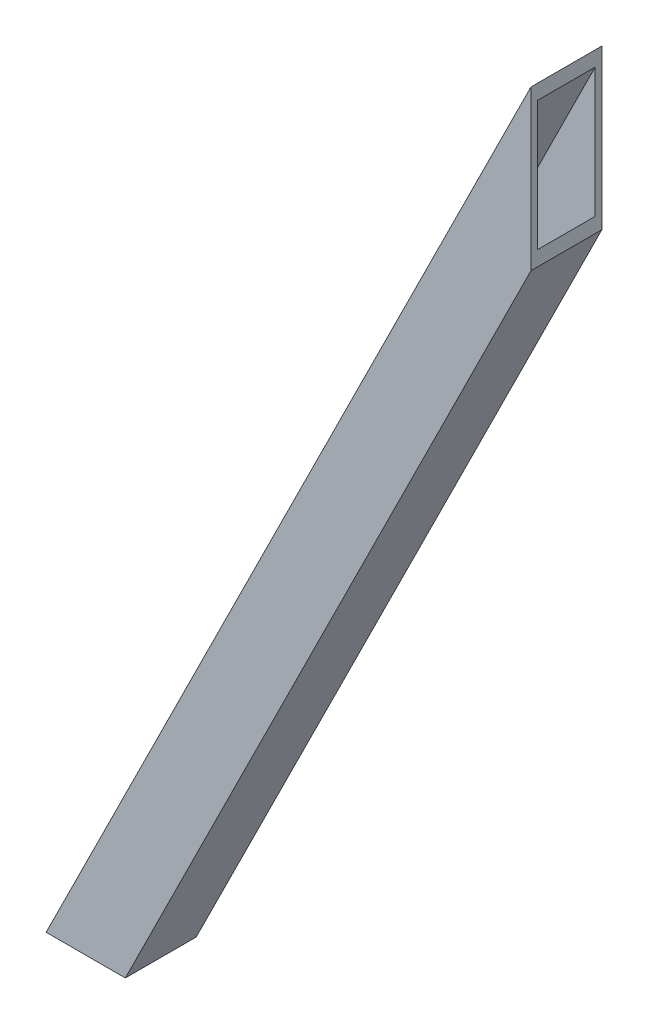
SolidWorks part; units mm, degrees
ref_plane "Plan1" through (0, 0, 0) normal (0, 0, 1) x (1, 0, 0)
ref_plane "Plan2" through (0, 0, 0) normal (0, 1, 0) x (1, 0, 0)
ref_plane "Plan3" through (0, 0, 0) normal (1, 0, 0) x (0, 0, -1)
sketch "Esquisse1" plane through (0, 0, 0) normal (0, 0, 1) x (1, 0, 0)
  line L0 (0, 202) -> (-100.5, 0)
  dimension "D1" = 202
  dimension "D2" = 100.5
ref_plane "Plan4" through (-100.5, 0, 0) normal (-0.4454, -0.8953, 0) x (0.8953, -0.4454, 0)
sketch "Esquisse3" plane through (-100.5, 0, 0) normal (-0.4454, -0.8953, 0) x (0.8953, -0.4454, 0)
  line L0 (0, 19.2147) -> (0, -27.2447) construction
  line L1 (-18.9857, 0) -> (24.0323, 0) construction
  line L2 (139.9788, 0) -> (39.9788, 0) construction
  line L3 (-8, 8) -> (8, 8)
  line L4 (-8, 8) -> (-8, -8)
  line L5 (8, -8) -> (-8, -8)
  line L6 (8, -8) -> (8, 8)
  dimension "D1" = 16
sweep "Base-Balayage" add profiles "Esquisse3" path "Esquisse1"
sketch "Esquisse4" plane through (-19.9409, -40.0802, 0) normal (-0.4454, -0.8953, 0) x (0.8953, -0.4454, 0)
  line L4 (-96.4788, 6.5) -> (-96.4788, -6.5)
  line L5 (-96.4788, -6.5) -> (-83.4788, -6.5)
  line L6 (-83.4788, -6.5) -> (-83.4788, 6.5)
  line L7 (-83.4788, 6.5) -> (-96.4788, 6.5)
  line L8 (-96.4788, 6.5) -> (-96.4788, -6.5)
  line L9 (-96.4788, -6.5) -> (-83.4788, -6.5)
  line L10 (-83.4788, -6.5) -> (-83.4788, 6.5)
  line L11 (-83.4788, 6.5) -> (-96.4788, 6.5)
  dimension "D1" = 1.5
extrude "Enlèv. mat.-Extru.1" cut sketch "Esquisse4" against normal through all
sketch "Esquisse5" plane through (80.5591, 161.9198, 0) normal (0.4454, 0.8953, 0) x (-0.8953, 0.4454, 0)
  line L0 (96.4788, 6.5) -> (96.4788, -6.5) construction
  line L1 (96.4788, 6.5) -> (96.4788, -6.5)
  line L2 (96.4788, -6.5) -> (83.4788, -6.5) construction
  line L3 (96.4788, -6.5) -> (83.4788, -6.5)
  line L4 (97.9788, -8) -> (97.9788, 8)
  line L5 (97.9788, 8) -> (81.9788, 8)
  line L6 (81.9788, 8) -> (81.9788, -8)
  line L7 (81.9788, -8) -> (97.9788, -8)
  line L8 (97.9788, -8) -> (97.9788, 8)
  line L9 (97.9788, 8) -> (81.9788, 8)
  line L10 (81.9788, 8) -> (81.9788, -8)
  line L11 (81.9788, -8) -> (97.9788, -8)
  line L12 (83.4788, -6.5) -> (83.4788, 6.5) construction
  line L13 (83.4788, -6.5) -> (83.4788, 6.5)
  line L14 (83.4788, 6.5) -> (96.4788, 6.5) construction
  line L15 (83.4788, 6.5) -> (96.4788, 6.5)
  dimension "D1" = 0
extrude "Boss.-Extru.2" add sketch "Esquisse5" along normal blind 50
sketch "Esquisse6" plane through (-19.9409, -40.0802, 0) normal (-0.4454, -0.8953, 0) x (0.8953, -0.4454, 0)
  line L0 (-83.4788, -6.5) -> (-83.4788, 6.5) construction
  line L1 (-96.4788, -6.5) -> (-83.4788, -6.5) construction
  line L2 (-96.4788, 6.5) -> (-96.4788, -6.5) construction
  line L3 (-83.4788, 6.5) -> (-96.4788, 6.5) construction
  line L4 (-97.9788, 8) -> (-97.9788, -8)
  line L5 (-97.9788, -8) -> (-81.9788, -8)
  line L6 (-81.9788, -8) -> (-81.9788, 8)
  line L7 (-81.9788, 8) -> (-97.9788, 8)
  line L8 (-97.9788, 8) -> (-97.9788, -8)
  line L9 (-97.9788, -8) -> (-81.9788, -8)
  line L10 (-81.9788, -8) -> (-81.9788, 8)
  line L11 (-81.9788, 8) -> (-97.9788, 8)
  line L12 (-83.4788, -6.5) -> (-83.4788, 6.5)
  line L13 (-96.4788, -6.5) -> (-83.4788, -6.5)
  line L14 (-96.4788, 6.5) -> (-96.4788, -6.5)
  line L15 (-83.4788, 6.5) -> (-96.4788, 6.5)
  dimension "D1" = 0
extrude "Boss.-Extru.3" add sketch "Esquisse6" along normal blind 50
sketch "Esquisse7" plane through (0, 0, 0) normal (0, 0, 1) x (1, 0, 0)
  line L0 (0, 184.0402) -> (0, 219.9598)
  line L4 (-115.6095, -48.3291) -> (29.4345, 243.2021)
  line L5 (29.4345, 243.2021) -> (15.1095, 250.3291)
  line L6 (15.1095, 250.3291) -> (-129.9345, -41.2021)
  line L7 (-129.9345, -41.2021) -> (-115.6095, -48.3291)
  line L8 (0, 184.0402) -> (29.4345, 243.2021)
  line L9 (29.4345, 243.2021) -> (15.1095, 250.3291)
  line L10 (15.1095, 250.3291) -> (0, 219.9598)
  dimension "D1" = 0
extrude "Enlèv. mat.-Extru.2" cut sketch "Esquisse7" against normal through all and the other way through all
sketch "Esquisse8" plane through (0, 0, 0) normal (0, 0, 1) x (1, 0, 0)
  line L0 (-109.4354, 0) -> (-91.5646, 0)
  line L4 (0, 184.0402) -> (0, 219.9598)
  line L5 (0, 219.9598) -> (-129.9345, -41.2021)
  line L6 (-129.9345, -41.2021) -> (-115.6095, -48.3291)
  line L7 (-115.6095, -48.3291) -> (0, 184.0402)
  line L9 (-109.4354, 0) -> (-129.9345, -41.2021)
  line L10 (-129.9345, -41.2021) -> (-115.6095, -48.3291)
  line L11 (-115.6095, -48.3291) -> (-91.5646, 0)
  dimension "D1" = 0
extrude "Enlèv. mat.-Extru.3" cut sketch "Esquisse8" against normal through all and the other way through all
